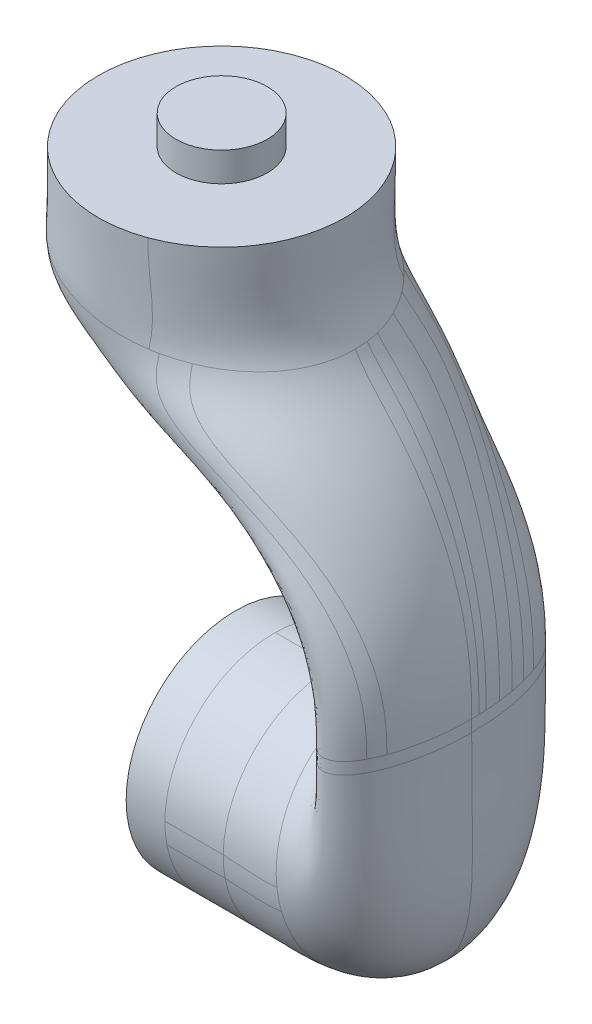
SolidWorks part; units mm, degrees
ref_plane "前视基准面" through (0, 0, 0) normal (0, 0, 1) x (1, 0, 0)
ref_plane "上视基准面" through (0, 0, 0) normal (0, 1, 0) x (1, 0, 0)
ref_plane "右视基准面" through (0, 0, 0) normal (1, 0, 0) x (0, 0, -1)
imported_body "输入1"
sketch "草图4" plane through (0, 105.5293, 0) normal (0, 1, 0) x (1, 0, 0)
  circle A0 centre (-22.0463, -1.0376) radius 42.2642
  circle A1 centre (-22.0463, -1.0376) radius 15.6485
  spline S0 degree 3 poles (-1810.0978, -790.642) (-404.5477, -5.9453) (-45.7924, 105.4062) (13.411, 22.0275) (14.3196, 20.5669) (15.5492, 18.2904) (15.9368, 17.5173) (16.6668, 15.9418) (17.0098, 15.1373) (17.9568, 12.7111) (18.4832, 11.0685) (19.333, 7.735) (19.6563, 6.044) (19.9855, 3.4704) (20.0693, 2.6063) (20.1837, 0.8655) (20.2137, -0.0022) (20.2243, -2.5969) (20.1255, -4.3158) (19.7194, -7.7319) (19.4125, -9.4292) (18.7915, -11.9586) (18.5568, -12.8011) (18.0394, -14.4586) (17.7563, -15.2758) (16.8353, -17.6938) (16.1259, -19.2607) (14.5171, -22.3052) (13.6179, -23.7827) (11.6221, -26.6448) (10.5461, -27.9991) (8.2452, -30.5608) (7.0201, -31.7682) (5.0694, -33.4679) (4.4004, -34.0159) (3.0238, -35.0741) (2.3145, -35.5854) (0.1536, -37.0438) (-1.3373, -37.9209) (-96.2611, -86.225) (-370.4857, 208.6106) (-1201.2277, 1557.0067) knots -3.587173 -3.587173 -3.587173 -3.587173 0.0625 0.0625 0.125 0.125 0.15625 0.15625 0.1875 0.1875 0.25 0.25 0.3125 0.3125 0.34375 0.34375 0.375 0.375 0.4375 0.4375 0.5 0.5 0.53125 0.53125 0.5625 0.5625 0.625 0.625 0.6875 0.6875 0.75 0.75 0.8125 0.8125 0.84375 0.84375 0.875 0.875 0.9375 0.9375 4.726906 4.726906 4.726906 4.726906 only from (9.1558, 27.4702) to (-7.6474, -40.7734) construction
  spline S1 degree 3 poles (9.1558, 27.4702) (10.3326, 26.1822) (11.4175, 24.8351) (13.411, 22.0275) (14.3196, 20.5669) (15.5492, 18.2904) (15.9368, 17.5173) (16.6668, 15.9418) (17.0098, 15.1373) (17.9568, 12.7111) (18.4832, 11.0685) (19.333, 7.735) (19.6563, 6.044) (19.9855, 3.4704) (20.0693, 2.6063) (20.1837, 0.8655) (20.2137, -0.0022) (20.2243, -2.5969) (20.1255, -4.3158) (19.7194, -7.7319) (19.4125, -9.4292) (18.7915, -11.9586) (18.5568, -12.8011) (18.0394, -14.4586) (17.7563, -15.2758) (16.8353, -17.6938) (16.1259, -19.2607) (14.5171, -22.3052) (13.6179, -23.7827) (11.6221, -26.6448) (10.5461, -27.9991) (8.2452, -30.5608) (7.0201, -31.7682) (5.0694, -33.4679) (4.4004, -34.0159) (3.0238, -35.0741) (2.3145, -35.5854) (0.1536, -37.0438) (-1.3373, -37.9209) (-4.4177, -39.4885) (-6.0072, -40.1791) (-7.6474, -40.7734) knots 0 0 0 0 0.0625 0.0625 0.125 0.125 0.15625 0.15625 0.1875 0.1875 0.25 0.25 0.3125 0.3125 0.34375 0.34375 0.375 0.375 0.4375 0.4375 0.5 0.5 0.53125 0.53125 0.5625 0.5625 0.625 0.625 0.6875 0.6875 0.75 0.75 0.8125 0.8125 0.84375 0.84375 0.875 0.875 0.9375 0.9375 1 1 1 1
  spline S2 degree 3 poles (1766.0033, 788.4845) (358.6089, 2.7573) (0.5128, -107.9155) (-57.8799, -23.5278) (-58.8504, -21.9026) (-60.1442, -19.3605) (-60.5484, -18.4957) (-61.3011, -16.7304) (-61.6453, -15.8401) (-62.5837, -13.1466) (-63.0842, -11.3211) (-63.8395, -7.6114) (-64.0938, -5.7271) (-64.3457, -1.8972) (-64.3406, 0.0042) (-64.0779, 3.7809) (-63.8206, 5.6563) (-63.2434, 8.4496) (-63.0189, 9.3774) (-62.5039, 11.2261) (-62.2165, 12.1363) (-61.2669, 14.8259) (-60.5179, 16.5644) (-58.79, 19.933) (-57.8117, 21.5634) (-55.6164, 24.7119) (-54.4245, 26.1932) (-51.8606, 28.9787) (-50.4885, 30.2826) (-48.2928, 32.1031) (-47.538, 32.6874) (-45.9813, 33.8096) (-45.1883, 34.341) (-42.7669, 35.8485) (-41.0959, 36.7378) (-37.6428, 38.2896) (-35.8606, 38.9518) (94.8629, 77.5648) (363.44, -507.7225) (702.862, -1811.075) knots -3.263237 -3.263237 -3.263237 -3.263237 0.0625 0.0625 0.125 0.125 0.15625 0.15625 0.1875 0.1875 0.25 0.25 0.3125 0.3125 0.375 0.375 0.4375 0.4375 0.46875 0.46875 0.5 0.5 0.5625 0.5625 0.625 0.625 0.6875 0.6875 0.75 0.75 0.78125 0.78125 0.8125 0.8125 0.875 0.875 0.9375 0.9375 5.31436 5.31436 5.31436 5.31436 only from (-53.2478, -29.5461) to (-28.4137, 40.7447) construction
  spline S3 degree 3 poles (-53.2478, -29.5461) (-54.5423, -28.1293) (-55.7257, -26.641) (-57.8799, -23.5278) (-58.8504, -21.9026) (-60.1442, -19.3605) (-60.5484, -18.4957) (-61.3011, -16.7304) (-61.6453, -15.8401) (-62.5837, -13.1466) (-63.0842, -11.3211) (-63.8395, -7.6114) (-64.0938, -5.7271) (-64.3457, -1.8972) (-64.3406, 0.0042) (-64.0779, 3.7809) (-63.8206, 5.6563) (-63.2434, 8.4496) (-63.0189, 9.3774) (-62.5039, 11.2261) (-62.2165, 12.1363) (-61.2669, 14.8259) (-60.5179, 16.5644) (-58.79, 19.933) (-57.8117, 21.5634) (-55.6164, 24.7119) (-54.4245, 26.1932) (-51.8606, 28.9787) (-50.4885, 30.2826) (-48.2928, 32.1031) (-47.538, 32.6874) (-45.9813, 33.8096) (-45.1883, 34.341) (-42.7669, 35.8485) (-41.0959, 36.7378) (-37.6428, 38.2896) (-35.8606, 38.9518) (-32.1798, 40.0391) (-30.3109, 40.4556) (-28.4137, 40.7447) knots 0 0 0 0 0.0625 0.0625 0.125 0.125 0.15625 0.15625 0.1875 0.1875 0.25 0.25 0.3125 0.3125 0.375 0.375 0.4375 0.4375 0.46875 0.46875 0.5 0.5 0.5625 0.5625 0.625 0.625 0.6875 0.6875 0.75 0.75 0.78125 0.78125 0.8125 0.8125 0.875 0.875 0.9375 0.9375 1 1 1 1
  spline S4 degree 3 poles (-56.9835, 1953.1217) (122.3671, 376.2808) (88.4857, -21.7086) (-15.6537, -42.8665) (-17.7024, -43.1292) (-20.8164, -43.2967) (-21.8655, -43.3143) (-23.9476, -43.2719) (-24.9825, -43.2123) (-28.0694, -42.9213) (-30.1034, -42.5784) (-33.1186, -41.8389) (-34.1176, -41.5547) (-35.6069, -41.0706) (-36.1019, -40.8994) (-37.0805, -40.5408) (-37.5651, -40.3529) (-39.9656, -39.3712) (-41.8132, -38.4513) (-44.4772, -36.8729) (-45.3473, -36.3136) (-47.0509, -35.1274) (-47.8867, -34.4984) (-147.6399, 46.5588) (143.3882, 547.7123) (1002.1826, 1661.452) knots -6.188169 -6.188169 -6.188169 -6.188169 0.125 0.125 0.25 0.25 0.3125 0.3125 0.375 0.375 0.5 0.5 0.5625 0.5625 0.59375 0.59375 0.625 0.625 0.75 0.75 0.8125 0.8125 0.875 0.875 8.501058 8.501058 8.501058 8.501058 only from (-7.6474, -40.7734) to (-53.2478, -29.5461) construction
  spline S5 degree 3 poles (-7.6474, -40.7734) (-9.6147, -41.4862) (-11.6099, -42.0449) (-15.6537, -42.8665) (-17.7024, -43.1292) (-20.8164, -43.2967) (-21.8655, -43.3143) (-23.9476, -43.2719) (-24.9825, -43.2123) (-28.0694, -42.9213) (-30.1034, -42.5784) (-33.1186, -41.8389) (-34.1176, -41.5547) (-35.6069, -41.0706) (-36.1019, -40.8994) (-37.0805, -40.5408) (-37.5651, -40.3529) (-39.9656, -39.3712) (-41.8132, -38.4513) (-44.4772, -36.8729) (-45.3473, -36.3136) (-47.0509, -35.1274) (-47.8867, -34.4984) (-50.3193, -32.5217) (-51.8364, -31.0908) (-53.2478, -29.5461) knots 0 0 0 0 0.125 0.125 0.25 0.25 0.3125 0.3125 0.375 0.375 0.5 0.5 0.5625 0.5625 0.59375 0.59375 0.625 0.625 0.75 0.75 0.8125 0.8125 0.875 0.875 1 1 1 1
  spline S6 degree 3 poles (-331.5026, -1928.9839) (27.7664, -602.5459) (115.5318, 1.9679) (-10.9476, 39.7572) (-11.9552, 40.0181) (-13.9837, 40.464) (-15.0057, 40.6495) (-17.0652, 40.9454) (-18.1008, 41.0553) (-20.166, 41.1981) (-21.1981, 41.2313) (-132.3274, 40.7439) (-236.9084, -387.2187) (-327.0914, -1930.9066) knots -15.477126 -15.477126 -15.477126 -15.477126 0.25 0.25 0.375 0.375 0.5 0.5 0.625 0.625 0.75 0.75 14.090215 14.090215 14.090215 14.090215 only from (-4.1281, 37.2409) to (-28.4137, 40.7447) construction
  spline S7 degree 3 poles (-4.1281, 37.2409) (-6.0148, 38.124) (-7.9556, 38.8632) (-10.9476, 39.7572) (-11.9552, 40.0181) (-13.9837, 40.464) (-15.0057, 40.6495) (-17.0652, 40.9454) (-18.1008, 41.0553) (-20.166, 41.1981) (-21.1981, 41.2313) (-24.293, 41.2177) (-26.3544, 41.0585) (-28.4137, 40.7447) knots 0 0 0 0 0.25 0.25 0.375 0.375 0.5 0.5 0.625 0.625 0.75 0.75 1 1 1 1
  spline S8 degree 3 poles (-1925.0738, 452.9806) (-25.5702, -327.304) (77.8233, -22.0215) (1.88, 33.8297) (0.7233, 34.5957) (-101.7949, 95.4858) (-442.5552, -272.8328) (-1266.4354, -1505.7804) knots -16.3069 -16.3069 -16.3069 -16.3069 0.5 0.5 0.75 0.75 22.07232 22.07232 22.07232 22.07232 only from (9.1558, 27.4702) to (-4.1281, 37.2409) construction
  spline S9 degree 3 poles (9.1558, 27.4702) (7.2877, 29.5152) (5.2192, 31.3739) (1.88, 33.8297) (0.7233, 34.5957) (-1.6528, 36.007) (-2.8738, 36.6537) (-4.1281, 37.2409) knots 0 0 0 0 0.5 0.5 0.75 0.75 1 1 1 1
  point P7 (0, 0)
extrude "凸台-拉伸1" add sketch "草图4" along normal blind 10 contours A1
